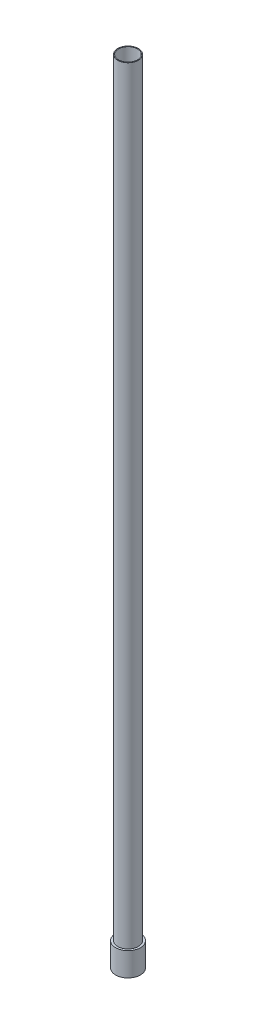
SolidWorks part; units mm, degrees
ref_plane "Front Plane" through (0, 0, 0) normal (0, 0, 1) x (1, 0, 0)
ref_plane "Top Plane" through (0, 0, 0) normal (0, 1, 0) x (1, 0, 0)
ref_plane "Right Plane" through (0, 0, 0) normal (1, 0, 0) x (0, 0, -1)
sketch "Sketch2" plane through (0, 0, 0) normal (0, 0, 1) x (1, 0, 0)
  line L0 (0, 0) -> (0, 304.8) construction
  line L1 (-3.6576, 0) -> (-4.7625, 0)
  line L2 (-4.7625, 0) -> (-4.7625, 9.1186)
  line L3 (-4.7625, 9.1186) -> (-3.9624, 9.1186)
  line L4 (-3.9624, 9.1186) -> (-3.9624, 304.8)
  line L5 (-3.9624, 304.8) -> (-3.6576, 304.8)
  line L6 (-3.6576, 0) -> (-3.6576, 304.8)
  dimension "D1" = 9.1186
  dimension "D2" = 9.525
  dimension "D3" = 7.9248
  dimension "D4" = 304.8
  dimension "D5" = 7.3152
revolve "Revolve1" add sketch "Sketch2" angle 360 about L0
